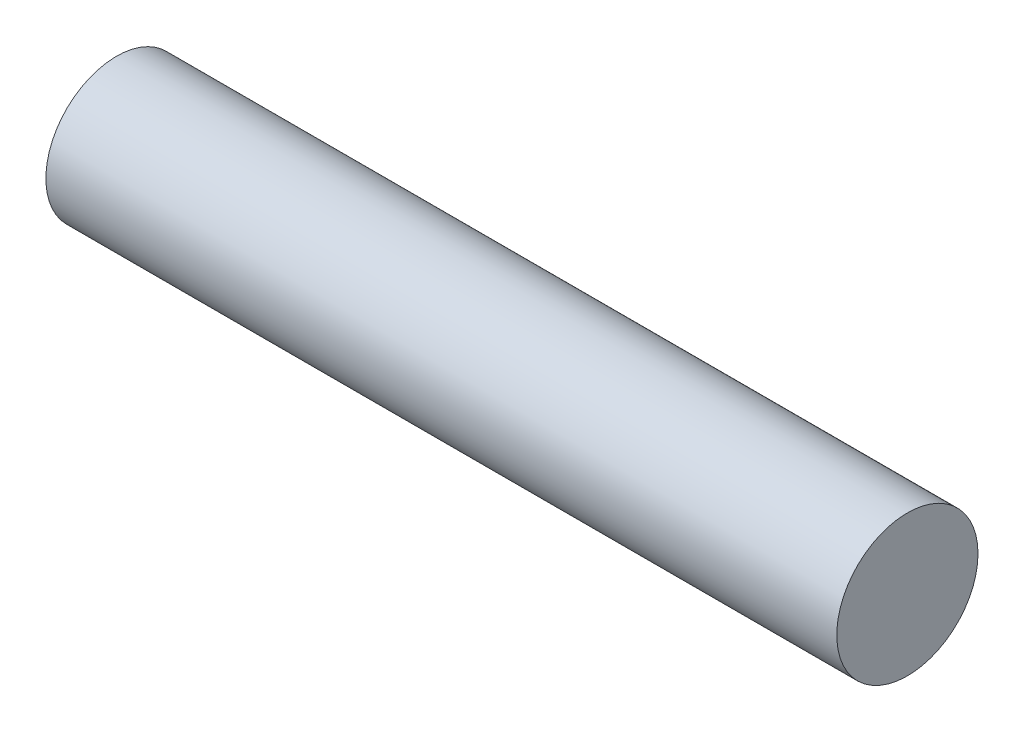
SolidWorks part; units mm, degrees
ref_plane "Vorderansicht" through (0, 0, 0) normal (0, 0, 1) x (1, 0, 0)
ref_plane "Draufsicht" through (0, 0, 0) normal (0, 1, 0) x (1, 0, 0)
ref_plane "Seitenansicht" through (0, 0, 0) normal (1, 0, 0) x (0, 0, -1)
sketch "Skizze1" plane through (0, 0, 0) normal (1, 0, 0) x (0, 0, -1)
  circle A0 centre (0, 0) radius 2.5
  dimension "D1" = 5
extrude "Linear austragen1" add sketch "Skizze1" along normal blind 28
